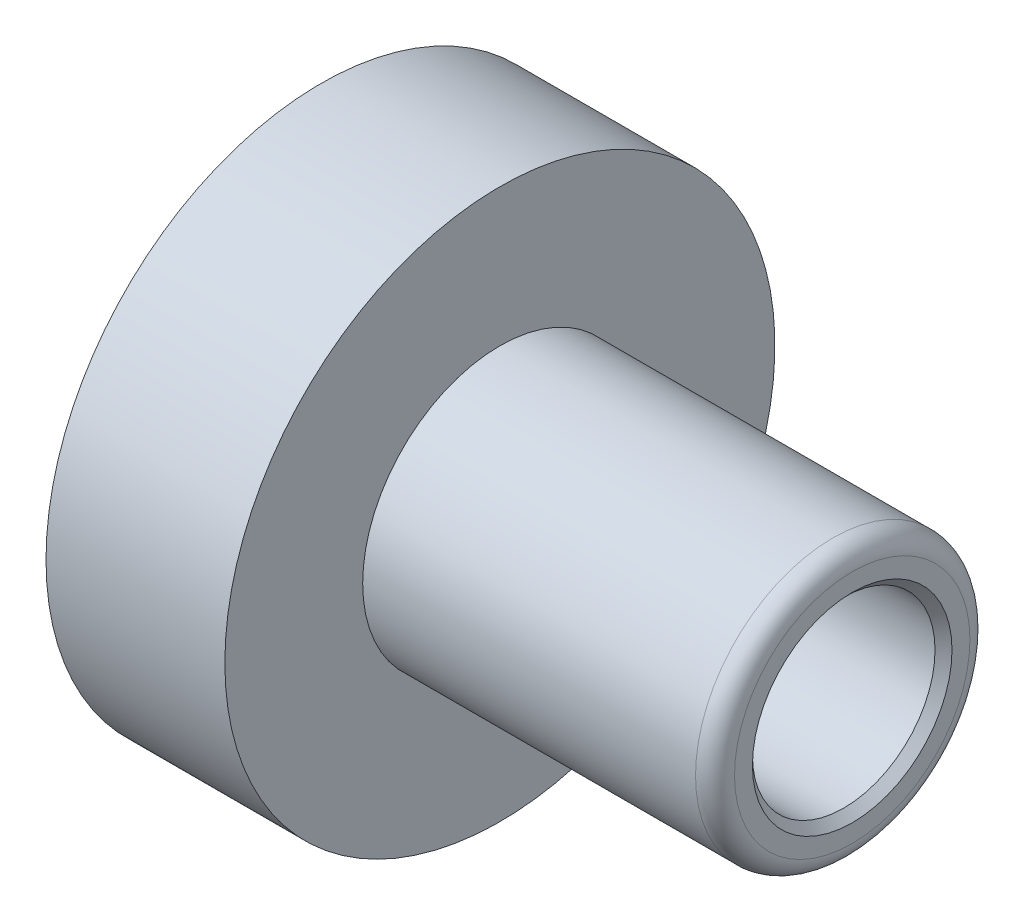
SolidWorks part; units mm, degrees
ref_plane "Front Plane" through (0, 0, 0) normal (0, 0, 1) x (1, 0, 0)
ref_plane "Top Plane" through (0, 0, 0) normal (0, 1, 0) x (1, 0, 0)
ref_plane "Right Plane" through (0, 0, 0) normal (1, 0, 0) x (0, 0, -1)
sketch "Sketch1" plane through (0, 0, 0) normal (0, 0, 1) x (1, 0, 0)
  line L0 (0, 0) -> (102.3864, 0) construction
  line L1 (0, 8.128) -> (0, 22.225)
  line L2 (0, 22.225) -> (14.4526, 22.225)
  line L3 (14.4526, 22.225) -> (14.4526, 11.0871)
  line L4 (14.4526, 11.0871) -> (41.3512, 11.0871)
  line L5 (42.926, 9.5123) -> (42.926, 0)
  line L6 (42.926, 0) -> (28.067, 0)
  line L7 (0, 8.128) -> (28.067, 8.128)
  line L8 (28.067, 8.128) -> (28.067, 0)
  arc A0 (42.926, 9.5123) -> (41.3512, 11.0871) centre (41.3512, 9.5123) ccw
  dimension "D5" = 1.5748
  dimension "D1" = 14.4526
  dimension "D2" = 44.45
  dimension "D3" = 28.067
  dimension "D4" = 16.256
  dimension "D6" = 42.926
  dimension "D7" = 22.1742
revolve "Revolve1" add sketch "Sketch1" angle 360 about L0
sketch "Sketch2" plane through (0, 0, 0) normal (-1, 0, 0) x (0, 0, 1)
  line L0 (0, 0) -> (0, 9.7644) construction
  circle A0 centre (-12.7, 0) radius 3.2004
  circle A1 centre (12.7, 0) radius 3.2004
  dimension "D2" = 6.4008
  dimension "D1" = 25.4
extrude "Cut-Extrude1" cut sketch "Sketch2" against normal blind 7.9502
sketch "Sketch3" plane through (42.926, 0, 0) normal (1, 0, 0) x (0, 0, -1)
  circle A0 centre (0, 0) radius 7.3787
  dimension "D1" = 14.7574
extrude "Cut-Extrude2" cut sketch "Sketch3" against normal through all
chamfer "Chamfer1" distance 0.6858 angle 45 1 edges at (42.926, 0, -7.3787)
